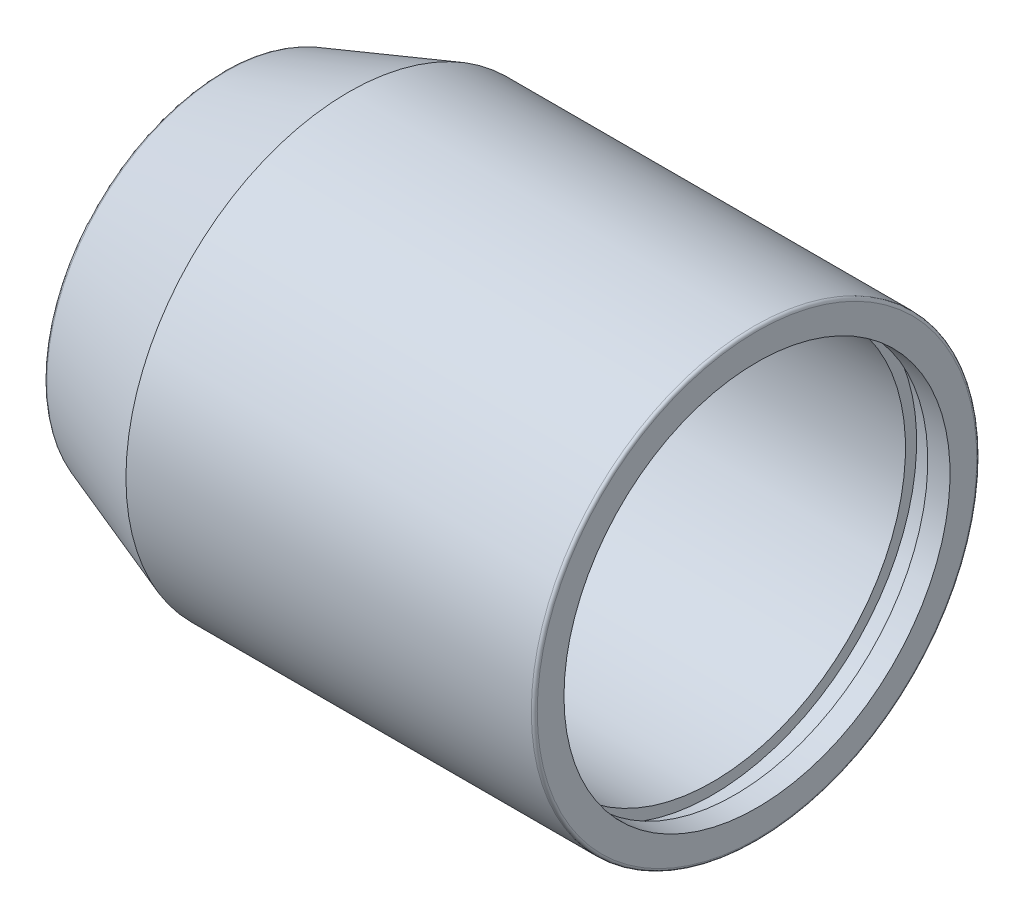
SolidWorks part; units mm, degrees
ref_plane "Plane1" through (0, 0, 0) normal (0, 0, 1) x (1, 0, 0)
ref_plane "Plane2" through (0, 0, 0) normal (0, 1, 0) x (1, 0, 0)
ref_plane "Plane3" through (0, 0, 0) normal (1, 0, 0) x (0, 0, -1)
sketch "Esquisse1" plane through (0, 0, 0) normal (0, 1, 0) x (1, 0, 0)
  line L0 (36, -15) -> (8.5, -15)
  line L1 (36, -15) -> (36, -13)
  line L3 (36, -13) -> (34.5, -13)
  line L4 (34.5, -13) -> (34.5, -13.75)
  line L5 (34.5, -13.75) -> (33, -13.75)
  line L6 (33, -13.75) -> (33, -13)
  line L7 (33, -13) -> (14, -13)
  line L8 (14, -13) -> (14, -11.5)
  line L9 (14, -11.5) -> (12.5, -11.5)
  line L10 (12.5, -11.5) -> (12.5, -13)
  line L11 (12.5, -13) -> (6.5, -13)
  line L12 (6.5, -13) -> (4.5, -11)
  line L13 (-15.5, 0) -> (22.5, 0) construction
  line L14 (0, -9.5) -> (4.5, -11)
  line L15 (0, -9.5) -> (0, -12)
  line L16 (0, -12) -> (8.5, -15)
  dimension "D1" = 2
  dimension "D2" = 135
  dimension "D3" = 199.44
  dimension "D4" = 4.5
  dimension "D5" = 36
  dimension "D6" = 26
  dimension "D7" = 23
  dimension "D8" = 13.75
  dimension "D9" = 19
  dimension "D10" = 22
  dimension "D11" = 26
  dimension "D12" = 8.5
  dimension "D13" = 12.5
  dimension "D14" = 14
  dimension "D15" = 33
  dimension "D16" = 1.5
revolve "Base-Révolution" add sketch "Esquisse1" angle 360 about L13
fillet "Congé2" radius 0.4
fillet "Congé3" radius 0.2
